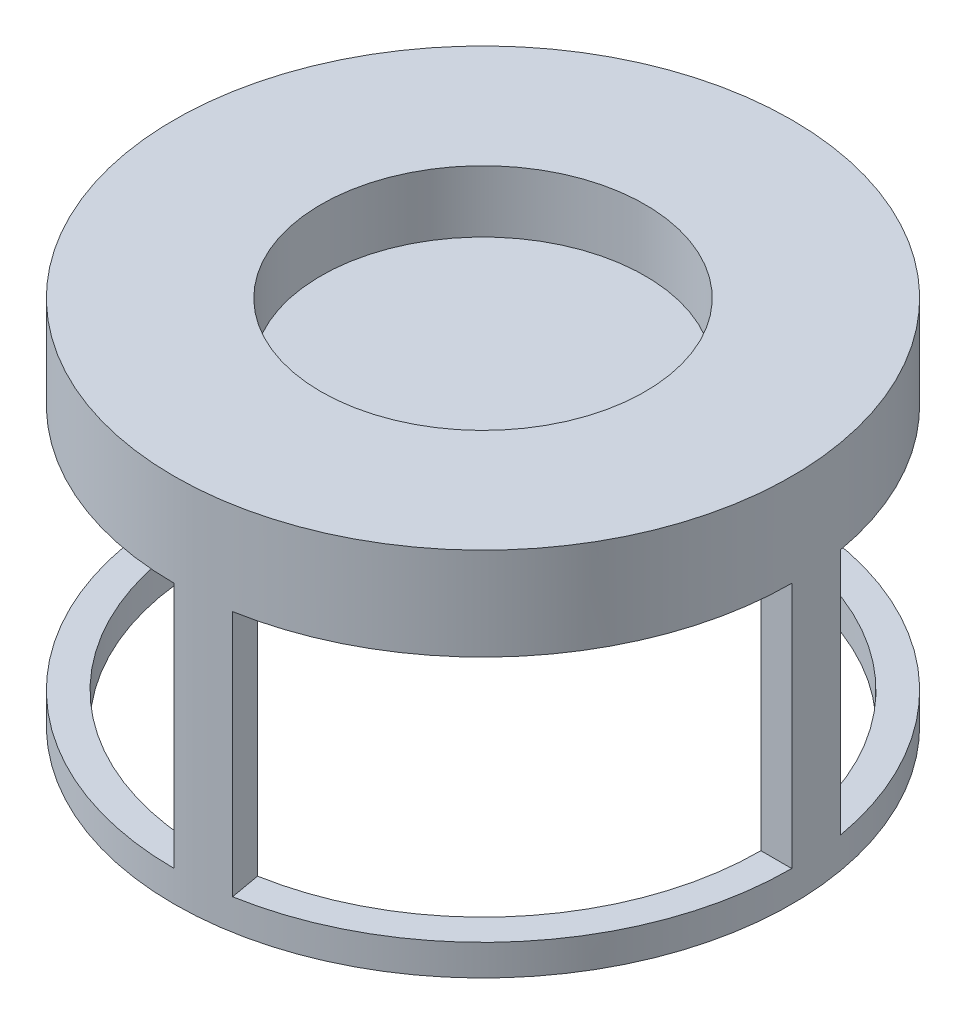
SolidWorks part; units mm, degrees
ref_plane "Front Plane" through (0, 0, 0) normal (0, 0, 1) x (1, 0, 0)
ref_plane "Top Plane" through (0, 0, 0) normal (0, 1, 0) x (1, 0, 0)
ref_plane "Right Plane" through (0, 0, 0) normal (1, 0, 0) x (0, 0, -1)
sketch "Sketch1" plane through (0, 0, 0) normal (0, 1, 0) x (1, 0, 0)
  circle A0 centre (0, 0) radius 25.4
  dimension "D1" = 50.8
extrude "Boss-Extrude1" add sketch "Sketch1" along normal blind 7.62
sketch "Sketch2" plane through (0, 7.62, 0) normal (0, 1, 0) x (1, 0, 0)
  circle A0 centre (0, 0) radius 13.335
  dimension "D1" = 26.67
extrude "Cut-Extrude1" cut sketch "Sketch2" against normal blind 5.08
sketch "Sketch3" plane through (0, 0, 0) normal (0, -1, 0) x (1, 0, 0)
  circle A0 centre (0, 0) radius 25.4
extrude "Boss-Extrude2" add sketch "Sketch3" along normal blind 22.86
sketch "Sketch4" plane through (0, -22.86, 0) normal (0, -1, 0) x (1, 0, 0)
  circle A2 centre (0, 0) radius 22.86
  circle A3 centre (0, 0) radius 22.86
  dimension "D1" = 2.54
extrude "Cut-Extrude2" cut sketch "Sketch4" against normal blind 22.86
sketch "Sketch5" plane through (0, 0, 0) normal (0, 0, 1) x (1, 0, 0)
  line L0 (-22.86, -22.86) -> (22.86, -22.86) construction
  line L1 (0, 0) -> (58.5728, 0)
  line L2 (0, 0) -> (0, -20.32)
  line L3 (0, -20.32) -> (58.5728, -20.32)
  line L4 (58.5728, 0) -> (58.5728, -20.32)
  dimension "D1" = 2.54
revolve "Cut-Revolve1" cut sketch "Sketch5" angle 80 about L2
pattern_circular "CirPattern4" count 4 over 360 about axis through (0, 7.62, 0) along (0, -1, 0) of "Cut-Revolve1"
shell "Shell1" thickness 2.54
